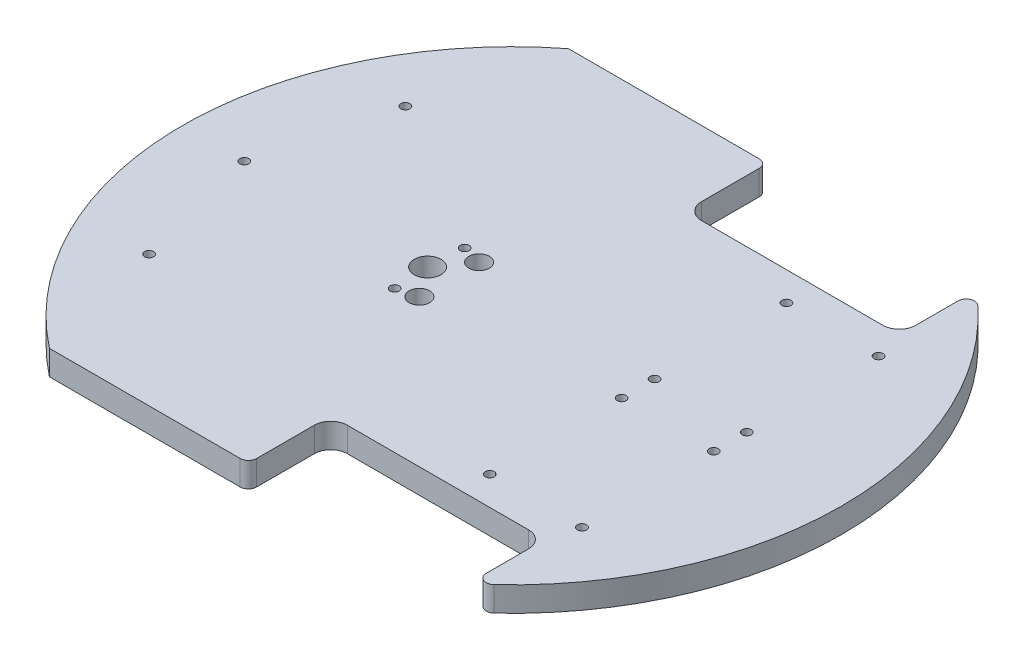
SolidWorks part; units mm, degrees
ref_plane "Plan de face" through (0, 0, 0) normal (0, 0, 1) x (1, 0, 0)
ref_plane "Plan de dessus" through (0, 0, 0) normal (0, 1, 0) x (1, 0, 0)
ref_plane "Plan de droite" through (0, 0, 0) normal (1, 0, 0) x (0, 0, -1)
sketch "Esquisse1" plane through (0, 0, 0) normal (0, 1, 0) x (1, 0, 0)
  line L0 (-111.0793, 0) -> (144.6389, 0) construction
  line L1 (0, -11.2854) -> (0, 92.4278) construction
  line L2 (-127.8768, -35.5) -> (-4.8538, -35.5) construction
  line L3 (-127.8768, 35.5) -> (-3.1135, 35.5) construction
  line L5 (-82, 79.8205) -> (-82, -51.6438) construction
  line L6 (4, 20.8682) -> (4, -38.6395) construction
  line L7 (-47.0686, -40) -> (71.6382, -40) construction
  line L8 (49.5, 20.8682) -> (49.5, -38.6395) construction
  line L9 (15.6, 11.6292) -> (15.6, -28.2202) construction
  line L10 (10.5621, -4) -> (39.9669, -4) construction
  line L11 (37.9, 11.6292) -> (37.9, -28.2202) construction
  line L12 (56.6736, -20) -> (46.2603, -20) construction
  line L13 (44.1725, -43) -> (-30.869, -43) construction
  line L14 (36, -93.4535) -> (36, -41.3056) construction
  line L15 (-16, -93.4535) -> (-16, -38.6395) construction
  line L16 (-111.0793, -63) -> (69.2583, -63) construction
  line L17 (-64.3052, -63) -> (-18, -63)
  line L19 (-16, -61) -> (-16, -47)
  line L20 (36, -57.2276) -> (36, -47)
  line L21 (-12, -43) -> (32, -43)
  line L23 (36, 57.2276) -> (36, 47)
  line L24 (-12, 43) -> (32, 43)
  line L25 (-16, 61) -> (-16, 47)
  line L26 (-64.3052, 63) -> (-18, 63)
  line L27 (-72.5, -38.6395) -> (-72.5, -16.737) construction
  line L28 (-40.7734, -7.25) -> (-7.8843, -7.25) construction
  line L29 (-76.4528, -31.1) -> (-20.4061, -31.1) construction
  line L30 (-35.5, 14.0513) -> (-35.5, -22.158) construction
  line L31 (-30.25, 14.0513) -> (-30.25, -14.8384) construction
  line L34 (-80, -11.2854) -> (-80, 32.0047) construction
  line L35 (-95, 32.0044) -> (-95, -4) construction
  line L36 (-21, 41.329) -> (-21, -33.2462) construction
  line L45 (-104, -14.8384) -> (-104, 14.0513) construction
  line L47 (10, 4) -> (10, -84.8277) construction
  line L48 (43.5, 11.6292) -> (43.5, -20) construction
  arc A0 (39.359, -58.695) -> (39.359, 58.695) centre (-15, 0) ccw
  circle A1 centre (15.6, -4) radius 1.1
  circle A2 centre (37.959, -4) radius 1.1
  circle A3 centre (37.959, -36) radius 1.1
  circle A4 centre (15.6, -36) radius 1.1
  circle A5 centre (37.959, 4) radius 1.1
  circle A6 centre (37.959, 36) radius 1.1
  circle A7 centre (15.6, 36) radius 1.1
  circle A8 centre (15.6, 4) radius 1.1
  arc A9 (36, 47) -> (32, 43) centre (32, 47) cw
  arc A10 (-64.3052, 63) -> (-64.3052, -63) centre (-15, 0) ccw
  arc A11 (-12, 43) -> (-16, 47) centre (-12, 47) cw
  arc A12 (32, -43) -> (36, -47) centre (32, -47) cw
  arc A13 (-16, -47) -> (-12, -43) centre (-12, -47) cw
  circle A14 centre (-35, -8.5) radius 1.1
  circle A15 centre (-30.25, 7.25) radius 2.5
  circle A16 centre (-72, -31.1) radius 1.1
  circle A17 centre (-72, 31.1) radius 1.1
  circle A18 centre (-80, 0) radius 1.1
  circle A19 centre (-35, 8.5) radius 1.1
  circle A20 centre (-35.5, 0) radius 3.25
  circle A21 centre (-30.25, -7.25) radius 2.5
  circle A22 centre (-80, 0) radius 9 construction
  circle A27 centre (-15, 0) radius 79 construction
  arc A29 (36, -57.2276) -> (39.359, -58.695) centre (38, -57.2276) ccw
  arc A30 (-18, -63) -> (-16, -61) centre (-18, -61) ccw
  arc A31 (39.359, 58.695) -> (36, 57.2276) centre (38, 57.2276) ccw
  arc A32 (-16, 61) -> (-18, 63) centre (-18, 61) ccw
  point P58 (36, 43)
  point P66 (-16, 43)
  point P69 (36, -61.636)
  point P71 (36, -43)
  point P74 (-16, -43)
  point P150 (-16, -63)
  point P155 (-16, 63)
  dimension "D8" = 20
  dimension "D9" = 4
  dimension "D13" = 52
  dimension "D12" = 26
  dimension "D16" = 4
  dimension "D21" = 5.25
  dimension "D23" = 15
  dimension "D35" = 6
  dimension "D36" = 2
  dimension "D3" = 35.5
  dimension "D4" = 71
  dimension "D5" = 40
  dimension "D6" = 6
  dimension "D7" = 45.5
  dimension "D10" = 11.6
  dimension "D11" = 22.3
  dimension "D14" = 3
  dimension "D15" = 20
  dimension "D17" = 7.25
  dimension "D18" = 37
  dimension "D19" = 31.1
extrude "Extrusion1" add sketch "Esquisse1" along normal blind 6
